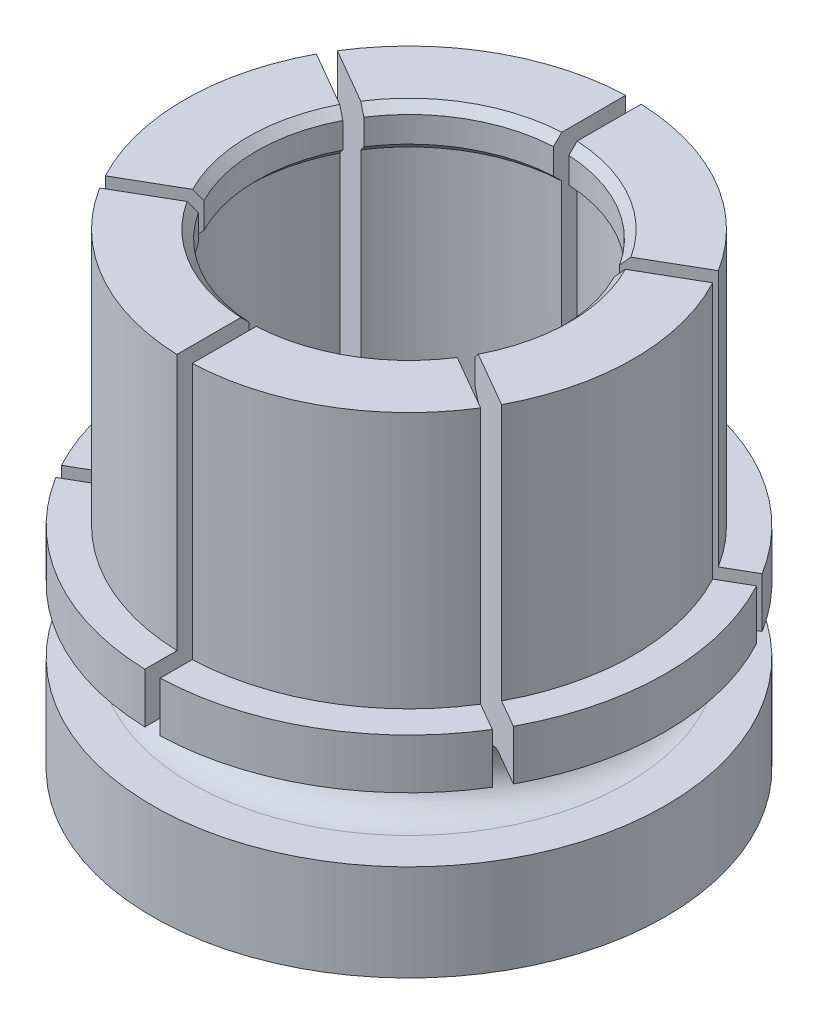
SolidWorks part; units mm, degrees
ref_plane "Front Plane" through (0, 0, 0) normal (0, 0, 1) x (1, 0, 0)
ref_plane "Top Plane" through (0, 0, 0) normal (0, 1, 0) x (1, 0, 0)
ref_plane "Right Plane" through (0, 0, 0) normal (1, 0, 0) x (0, 0, -1)
sketch "Sketch1" plane through (0, 0, 0) normal (0, 0, 1) x (1, 0, 0)
  line L0 (0, 0) -> (0, -25.4) construction
  line L1 (7.9502, -2.0879) -> (7.9502, -23.114)
  line L2 (7.9502, -23.114) -> (12.7, -23.114)
  line L3 (12.7, -23.114) -> (12.7, -12.7)
  line L4 (12.7, -12.7) -> (11.1125, -12.7)
  line L5 (11.1125, -12.7) -> (11.1125, 0)
  line L6 (11.1125, 0) -> (7.9502, 0)
  line L7 (7.9502, 0) -> (7.5413, -0.4089)
  line L8 (7.5413, -0.4089) -> (7.5413, -1.6789)
  line L9 (7.5413, -1.6789) -> (7.9502, -2.0879)
  dimension "D7" = 135
  dimension "D8" = 15.0825
  dimension "D1" = 25.4
  dimension "D2" = 15.9004
  dimension "D3" = 22.225
  dimension "D4" = 25.4
  dimension "D5" = 23.114
  dimension "D6" = 10.414
  dimension "D9" = 1.27
revolve "Revolve1" add sketch "Sketch1" angle 360 about L0
sketch "Sketch2" plane through (0, 0, 0) normal (0, 0, 1) x (1, 0, 0)
  line L1 (-0.381, 3.4448) -> (0.381, 3.4448)
  line L2 (-0.381, 3.4448) -> (-0.381, -16.764)
  line L3 (-0.381, -16.764) -> (0.381, -16.764)
  line L4 (0.381, 3.4448) -> (0.381, -16.764)
  line L5 (-12.7, -23.114) -> (12.7, -23.114) construction
  point P6 (0, 3.4448)
  dimension "D1" = 0.762
  dimension "D2" = 6.35
extrude "Cut-Extrude1" cut sketch "Sketch2" against normal through all and the other way through all
pattern_circular "CirPattern1" count 3 over 360 about axis through (0, 0, 0) along (0, 1, 0) of "Cut-Extrude1"
sketch "Sketch3" plane through (0, 0, 0) normal (0, 0, 1) x (1, 0, 0)
  line L1 (10.795, -15.1765) -> (12.7, -15.1765)
  line L2 (12.7, -18.3515) -> (10.795, -18.3515)
  line L3 (0, 0) -> (0, -25.4) construction
  line L4 (0.381, -16.764) -> (-0.381, -16.764) construction
  arc A0 (10.795, -15.1765) -> (10.795, -18.3515) centre (10.795, -16.764) ccw
  arc A1 (12.7, -18.3515) -> (12.7, -15.1765) centre (12.7, -16.764) ccw
  dimension "D1" = 3.175
  dimension "D2" = 10.795
  dimension "D3" = 1.905
revolve "Cut-Revolve1" cut sketch "Sketch3" angle 360 about axis through (0, 0, 0) along (0, -1, 0)
